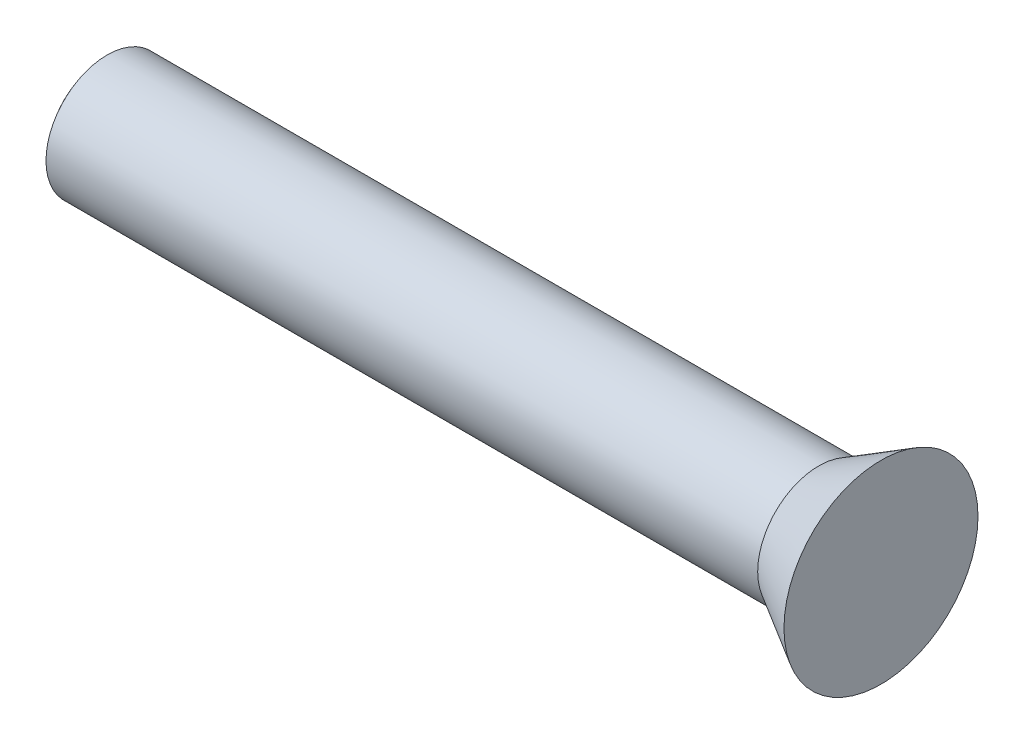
SolidWorks part; units mm, degrees
ref_plane "Front Plane" through (0, 0, 0) normal (0, 0, 1) x (1, 0, 0)
ref_plane "Top Plane" through (0, 0, 0) normal (0, 1, 0) x (1, 0, 0)
ref_plane "Right Plane" through (0, 0, 0) normal (1, 0, 0) x (0, 0, -1)
sketch "Sketch1" plane through (0, 0, 0) normal (0, 0, 1) x (1, 0, 0)
  line L0 (19.6886, 0) -> (110.1178, 0) construction
  line L1 (-0.9863, 0.8001) -> (8.3301, 0.8001)
  line L2 (8.3301, 0.8001) -> (9.144, 1.27)
  line L3 (9.144, 1.27) -> (9.144, 0)
  line L4 (9.144, 0) -> (-1.27, 0)
  arc A0 (-1.27, 0) -> (-0.9863, 0.8001) centre (0, 0) cw
  dimension "D1" = 1.27
  dimension "D2" = 10.414
  dimension "D3" = 1.6002
  dimension "D4" = 30
  dimension "D5" = 1.27
revolve "Revolve1" add sketch "Sketch1" angle 360 about L0
